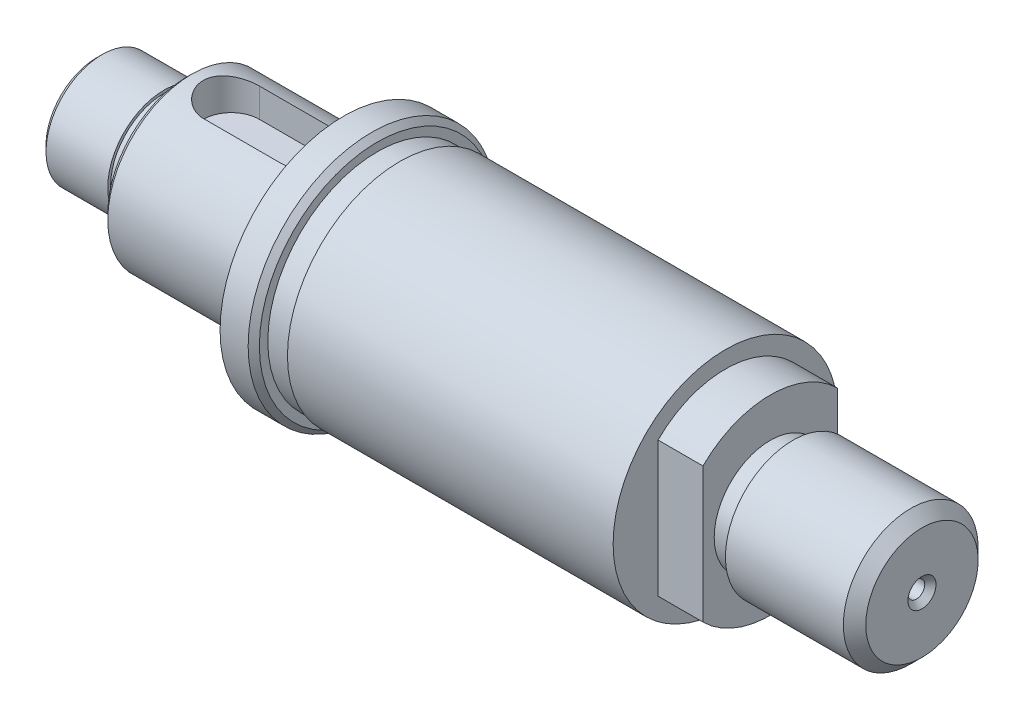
SolidWorks part; units mm, degrees
ref_plane "Plan de face" through (0, 0, 0) normal (0, 0, 1) x (1, 0, 0)
ref_plane "Plan de dessus" through (0, 0, 0) normal (0, 1, 0) x (1, 0, 0)
ref_plane "Plan de droite" through (0, 0, 0) normal (1, 0, 0) x (0, 0, -1)
sketch "Esquisse1" plane through (0, 0, 0) normal (0, 0, 1) x (1, 0, 0)
  line L0 (0, 0) -> (93.6052, 0) construction
  line L1 (0, 0) -> (0, 5)
  line L2 (0, 5) -> (6, 5)
  line L3 (6, 5) -> (6, 4.75)
  line L4 (6, 4.75) -> (8, 4.75)
  line L5 (8, 4.75) -> (8, 7.5)
  line L6 (8, 7.5) -> (22, 7.5)
  line L7 (22, 7.5) -> (22, 11)
  line L8 (22, 11) -> (25, 11)
  line L9 (25, 11) -> (25, 9.75)
  line L10 (25, 9.75) -> (27, 9.75)
  line L11 (27, 9.75) -> (27, 10)
  line L12 (27, 10) -> (56, 10)
  line L13 (56, 10) -> (56, 8.5)
  line L14 (56, 8.5) -> (60, 8.5)
  line L15 (60, 8.5) -> (60, 5)
  line L16 (60, 5) -> (62, 5)
  line L17 (62, 5) -> (62, 6)
  line L18 (62, 6) -> (73.5, 6)
  line L19 (73.5, 6) -> (73.5, 0)
  line L20 (73.5, 0) -> (0, 0)
  dimension "D1" = 9.5
  dimension "D2" = 10
  dimension "D3" = 15
  dimension "D4" = 22
  dimension "D5" = 20
  dimension "D6" = 19.5
  dimension "D7" = 17
  dimension "D8" = 12
  dimension "D9" = 10
  dimension "D10" = 73.5
  dimension "D11" = 6
  dimension "D12" = 8
  dimension "D13" = 14
  dimension "D14" = 31
  dimension "D15" = 2
  dimension "D16" = 48
  dimension "D17" = 4
  dimension "D18" = 2
revolve "Révolution1" add sketch "Esquisse1" angle 360 about L0
chamfer "Chanfrein1" distance 0.5 angle 45 4 edges at (8, 0, 7.5) (8, 0, 4.75) (0, 0, 5) (25, 0, 11)
sketch "Esquisse2" plane through (60, 0, 0) normal (1, 0, 0) x (0, 0, -1)
  line L0 (0, 0) -> (0, 9.2784) construction
  line L1 (-6, 12.5735) -> (-6, -12.5735)
  line L2 (6, 12.5735) -> (6, -12.5735)
  arc A0 (-6, 12.5735) -> (-6, -12.5735) centre (0, 0) ccw
  arc A1 (6, -12.5735) -> (6, 12.5735) centre (0, 0) ccw
  dimension "D1" = 12
extrude "Enlèv. mat.-Extru.1" cut sketch "Esquisse2" against normal up to surface (4 mm away)
chamfer "Chanfrein2" distance 1 angle 45 1 edges at (73.5, 0, 6)
hole_wizard "Diamètre du perçage Ø1.5 (1.5)1" positions "Esquisse4" profile "Esquisse3" hole size "Ø1.5" standard "ISO"
sketch "Esquisse4" plane through (73.5, 0, 0) normal (1, 0, 0) x (0, 0, -1)
  circle A0 centre (0, 0) radius 5 construction
  point P0 (0, 0)
sketch "Esquisse3" plane through (73.5, 0, 0) normal (0, 1, 0) x (0, 0, -1)
  line L0 (0, 0) -> (0, 2.4506)
  line L1 (0, 2.4506) -> (0.75, 2)
  line L2 (0.75, 2) -> (0.75, 0)
  line L5 (0.75, 0) -> (0, 0)
  line L10 (0, 2.4506) -> (-0.75, 2) construction
  line L11 (0, -6.35) -> (0, 107.95) construction
  dimension "Diamètre du perçage" = 1.5
  dimension "Profondeur du perçage" = 2
  dimension "Angle de pointe" = 118
chamfer "Chanfrein3" distance 0.5 angle 45 1 edges at (73.5, 0, -0.75)
hole_wizard "Diamètre du perçage Ø1.5 (1.5)2" positions "Esquisse6" profile "Esquisse5" hole size "Ø1.5" standard "ISO"
sketch "Esquisse6" plane through (0, 0, 0) normal (-1, 0, 0) x (0, 0, 1)
  point P0 (0, 0)
sketch "Esquisse5" plane through (0, 0, 0) normal (0, 1, 0) x (0, 0, 1)
  line L0 (0, 0) -> (0, 2.4506)
  line L1 (0, 2.4506) -> (0.75, 2)
  line L2 (0.75, 2) -> (0.75, 0)
  line L5 (0.75, 0) -> (0, 0)
  line L10 (0, 2.4506) -> (-0.75, 2) construction
  line L11 (0, -6.35) -> (0, 107.95) construction
  dimension "Diamètre du perçage" = 1.5
  dimension "Profondeur du perçage" = 2
  dimension "Angle de pointe" = 118
chamfer "Chanfrein4" distance 0.5 angle 45 1 edges at (0, 0, 0.75)
ref_plane "Plan1" through (0, 4.5, 0) normal (0, 1, 0) x (-1, 0, 0)
sketch "Esquisse7" plane through (0, 4.5, 0) normal (0, 1, 0) x (-1, 0, 0)
  line L0 (0, 0) -> (-29.9995, 0) construction
  line L1 (-19, 2.5) -> (-12, 2.5)
  line L2 (-19, -2.5) -> (-12, -2.5)
  line L3 (-22, -11) -> (-22, 11) construction
  arc A0 (-19, 2.5) -> (-19, -2.5) centre (-19, 0) ccw
  arc A1 (-12, -2.5) -> (-12, 2.5) centre (-12, 0) ccw
  dimension "D1" = 5
  dimension "D2" = 7
  dimension "D3" = 3
extrude "Enlèv. mat.-Extru.2" cut sketch "Esquisse7" along normal through all
